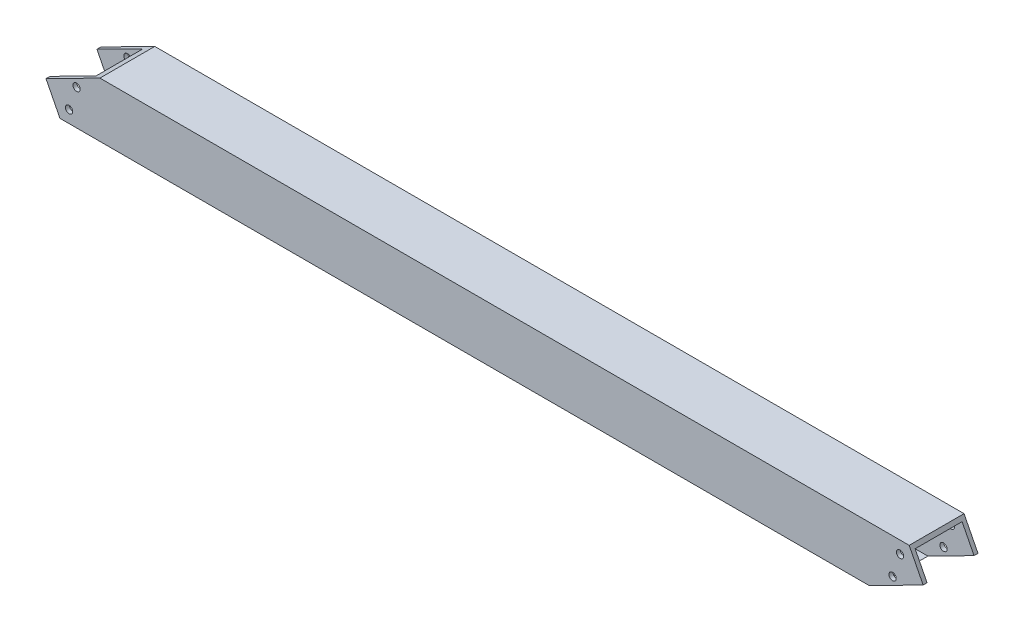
SolidWorks part; units mm, degrees
ref_plane "Front" through (0, 0, 0) normal (0, 0, 1) x (1, 0, 0)
ref_plane "Top" through (0, 0, 0) normal (0, 1, 0) x (1, 0, 0)
ref_plane "Right" through (0, 0, 0) normal (1, 0, 0) x (0, 0, -1)
sketch "Sketch1" plane through (0, 0, 0) normal (1, 0, 0) x (0, 0, -1)
  line L1 (0, 0) -> (50.8, 0)
  line L2 (0, 0) -> (0, 50.8)
  line L3 (0, 50.8) -> (50.8, 50.8)
  line L4 (50.8, 0) -> (50.8, 50.8)
  line L5 (3.6576, 47.1424) -> (47.1424, 47.1424)
  line L6 (3.6576, 47.1424) -> (3.6576, 3.6576)
  line L7 (3.6576, 3.6576) -> (47.1424, 3.6576)
  line L8 (47.1424, 47.1424) -> (47.1424, 3.6576)
  dimension "D1" = 50.8
  dimension "D2" = 50.8
  dimension "D3" = 3.6576
  dimension "D4" = 3.6576
  dimension "D5" = 3.6576
  dimension "D6" = 3.6576
extrude "Extrude1" add sketch "Sketch1" along normal blind 3048
sketch "Sketch3" plane through (0, 0, -50.8) normal (0, 0, -1) x (-1, 0, 0)
  line L0 (-3048, 0) -> (-3048, 50.8) construction
  line L1 (-3048, 50.8) -> (0, 50.8) construction
  line L2 (-3048, 0) -> (0, 0) construction
  line L4 (-44.45, 38.1) -> (-19.05, 12.7) construction
  line L5 (-31.75, 25.4) -> (-31.75, -21.9689) construction
  circle A0 centre (-3003.55, 12.7) radius 3.3731
  circle A1 centre (-3028.95, 38.1) radius 3.3731
  circle A2 centre (-19.05, 12.7) radius 3.3731
  circle A3 centre (-44.45, 38.1) radius 3.3731
  dimension "D1" = 6.7462
  dimension "D3" = 12.7
  dimension "D5" = 12.7
  dimension "D2" = 19.05
  dimension "D4" = 44.45
sketch "Sketch4" plane through (0, 0, -50.8) normal (0, 0, -1) x (-1, 0, 0)
  line L0 (-3048, 25.4) -> (-2311.975, 25.4) construction
  line L1 (-3048, 0) -> (-3048, 50.8) construction
  line L2 (-3048, 25.4) -> (-2880.9917, 353.6577)
  line L3 (-2880.9917, 353.6577) -> (-2235.7955, 25.4)
  line L4 (-2235.7955, 25.4) -> (-2402.8038, -302.8577)
  line L5 (-2402.8038, -302.8577) -> (-3048, 25.4)
  line L7 (-3241.8577, 433.6633) -> (76.466, 433.6633)
  line L8 (-3241.8577, 433.6633) -> (-3241.8577, -355.3713)
  line L9 (-3241.8577, -355.3713) -> (76.466, -355.3713)
  line L10 (76.466, 433.6633) -> (76.466, -355.3713)
  dimension "D1" = 368.3
  dimension "D2" = 723.9
extrude "Cut-Extrude3" cut sketch "Sketch4" against normal through all
sketch "Sketch5" plane through (0, 0, 0) normal (0, 0, 1) x (1, 0, 0)
  circle A0 centre (3026.6503, 39.474) radius 3.3731
  circle A1 centre (3019.6999, 18.1263) radius 3.3731
  circle A2 centre (2257.1452, 11.326) radius 3.3731
  circle A3 centre (2264.0956, 32.6737) radius 3.3731
  dimension "D1" = 6.7462
extrude "Cut-Extrude4" cut sketch "Sketch5" against normal through all
